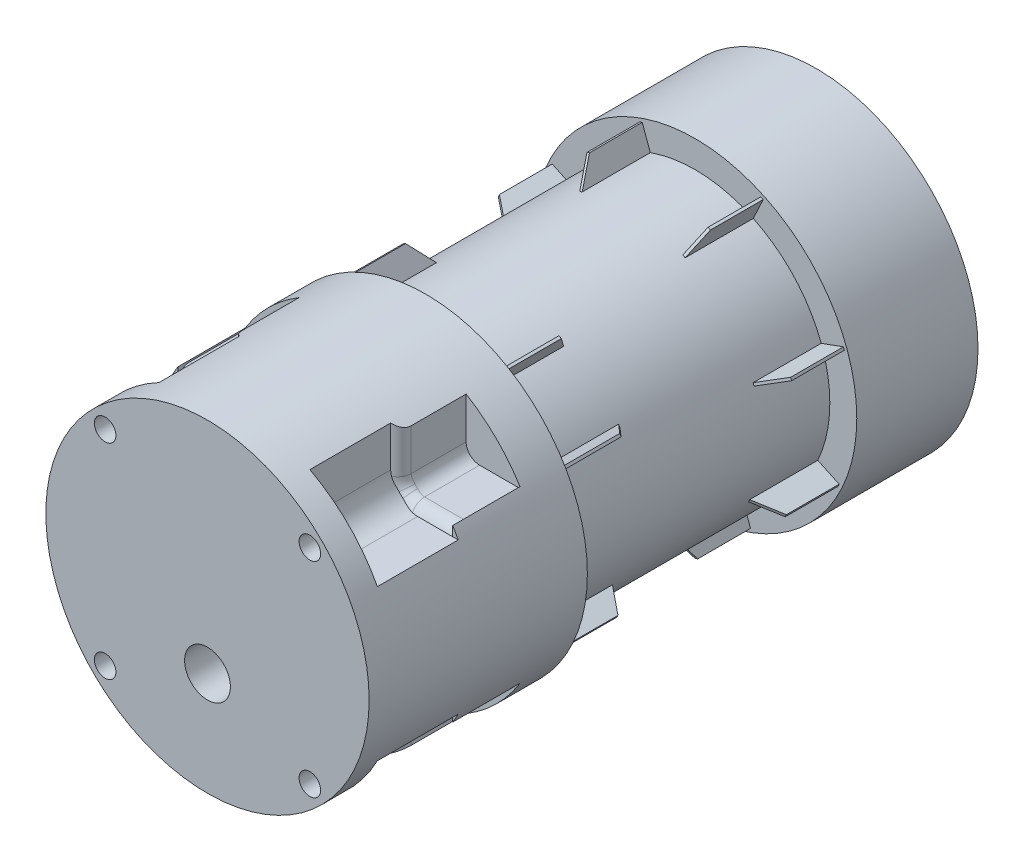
SolidWorks part; units mm, degrees
ref_plane "Face" through (0, 0, 0) normal (0, 0, 1) x (1, 0, 0)
ref_plane "Dessus" through (0, 0, 0) normal (0, 1, 0) x (1, 0, 0)
ref_plane "Droite" through (0, 0, 0) normal (1, 0, 0) x (0, 0, -1)
sketch "Esquisse1" plane through (0, 0, 0) normal (0, 0, 1) x (1, 0, 0)
  circle A0 centre (0, 0) radius 60
  dimension "D1" = 120
extrude "Base-Extrusion" add sketch "Esquisse1" against normal blind 81
sketch "Esquisse2" plane through (0, 0, -81) normal (0, 0, -1) x (-1, 0, 0)
  circle A0 centre (0, 0) radius 50
  dimension "D1" = 100
extrude "Boss.-Extru.1" add sketch "Esquisse2" along normal blind 100
sketch "Esquisse3" plane through (0, 0, -181) normal (0, 0, -1) x (-1, 0, 0)
  circle A0 centre (0, 0) radius 60
  dimension "D1" = 120
extrude "Boss.-Extru.2" add sketch "Esquisse3" along normal blind 45
sketch "Esquisse4" plane through (0, 0, 0) normal (0, 0, 1) x (1, 0, 0)
  circle A0 centre (0, -21.5) radius 8.5
  dimension "D1" = 17
  dimension "D2" = 21.5
extrude "Enlèv. mat.-Extru.1" cut sketch "Esquisse4" against normal blind 50
sketch "Esquisse5" plane through (0, 0, 0) normal (0, 0, 1) x (1, 0, 0)
  line L0 (-60, 38) -> (50, 38) construction
  line L1 (-60, -38) -> (60, -38) construction
  line L2 (-38, 60) -> (-38, -50) construction
  line L3 (38, 60) -> (38, -60) construction
  circle A0 centre (-38, 38) radius 4
  dimension "D5" = 8
  dimension "D1" = 76
  dimension "D2" = 38
  dimension "D3" = 76
  dimension "D4" = 38
extrude "Enlèv. mat.-Extru.2" cut sketch "Esquisse5" against normal blind 15
mirror "Symétrie1" about plane through (0, 0, 0) normal (1, 0, 0)
mirror "Symétrie2" about plane through (0, 0, 0) normal (0, 1, 0)
ref_plane "Plan1" through (0, 0, -10) normal (0, 0, 1) x (1, 0, 0)
sketch "Esquisse6" plane through (0, 0, -10) normal (0, 0, 1) x (1, 0, 0)
  line L0 (28, 60) -> (28, 28)
  line L1 (28, 28) -> (68, 28)
  line L2 (68, 28) -> (68, 60)
  line L3 (28, 60) -> (68, 60)
  circle A0 centre (38, 38) radius 4 construction
  dimension "D1" = 10
  dimension "D3" = 10
  dimension "D2" = 40
extrude "Enlèv. mat.-Extru.3" cut sketch "Esquisse6" against normal blind 30
mirror "Symétrie3" about plane through (0, 0, 0) normal (0, 1, 0)
mirror "Symétrie4" about plane through (0, 0, 0) normal (1, 0, 0)
sketch "Esquisse7" plane through (0, 0, -40) normal (0, 0, 1) x (1, 0, 0)
  line L0 (-31, 31) -> (-31, 61)
  line L1 (-31, 61) -> (-51, 61)
  line L2 (-51, 61) -> (-51, 31)
  line L3 (-51, 31) -> (-31, 31)
  circle A0 centre (-38, 38) radius 4 construction
  dimension "D1" = 7
  dimension "D2" = 7
  dimension "D3" = 30
  dimension "D4" = 20
extrude "Enlèv. mat.-Extru.4" cut sketch "Esquisse7" against normal blind 25
fillet "Congé1" radius 5
fillet "Congé2" radius 10
fillet "Congé3" radius 5
mirror "Symétrie7" about plane through (0, 0, 0) normal (1, 0, 0)
mirror "Symétrie8" about plane through (0, 0, 0) normal (0, 1, 0)
fillet "Congé4" radius 5
fillet "Congé5" radius 5
fillet "Congé6" radius 10
fillet "Congé9" radius 5
fillet "Congé11" radius 5
fillet "Congé12" radius 10
fillet "Congé13" radius 5
fillet "Congé14" radius 5
fillet "Congé15" radius 10
ref_plane "Plan2" through (0, 0, 0) normal (0.866, 0.5, 0) x (0, 0, -1)
ref_plane "Plan3" through (0, 0, 0) normal (0.5, 0.866, 0) x (-0.866, 0.5, 0)
sketch "Esquisse9" plane through (0, 0, 0) normal (0.866, 0.5, 0) x (0, 0, -1)
  line L0 (78.9463, 58.6883) -> (102.4216, 58.6883)
  line L1 (102.4216, 58.6883) -> (111.6958, 47.3853)
rib "Nervure2" sketch "Esquisse9" sketch "Esquisse9" thickness 1 extrusion direction parallel to sketch draft on no parameters "D1"=1
sketch "Esquisse10" plane through (0, 0, 0) normal (0.5, 0.866, 0) x (-0.866, 0.5, 0)
  line L0 (57.9467, -79.0571) -> (57.9467, -101.9358)
  line L1 (57.9467, -101.9358) -> (47.445, -108.3118)
rib "Nervure3" sketch "Esquisse10" sketch "Esquisse10" thickness 1 extrusion direction parallel to sketch draft on no parameters "D1"=1
pattern_circular "Répétition circulaire1" count 4 over 360
ref_plane "Plan4" through (0, 0, 0) normal (0.4226, 0.9063, 0) x (-0.9063, 0.4226, 0)
sketch "Esquisse12" plane through (0, 0, 0) normal (0.4226, 0.9063, 0) x (-0.9063, 0.4226, 0)
  line L0 (-58.7593, -182.8325) -> (-58.7593, -161.4005)
  line L1 (-58.7593, -161.4005) -> (-46.6145, -153.5421)
rib "Nervure6" sketch "Esquisse12" sketch "Esquisse12" thickness 1 extrusion direction parallel to sketch draft on no parameters "D1"=1
pattern_circular "Répétition circulaire3" count 8 over 360
